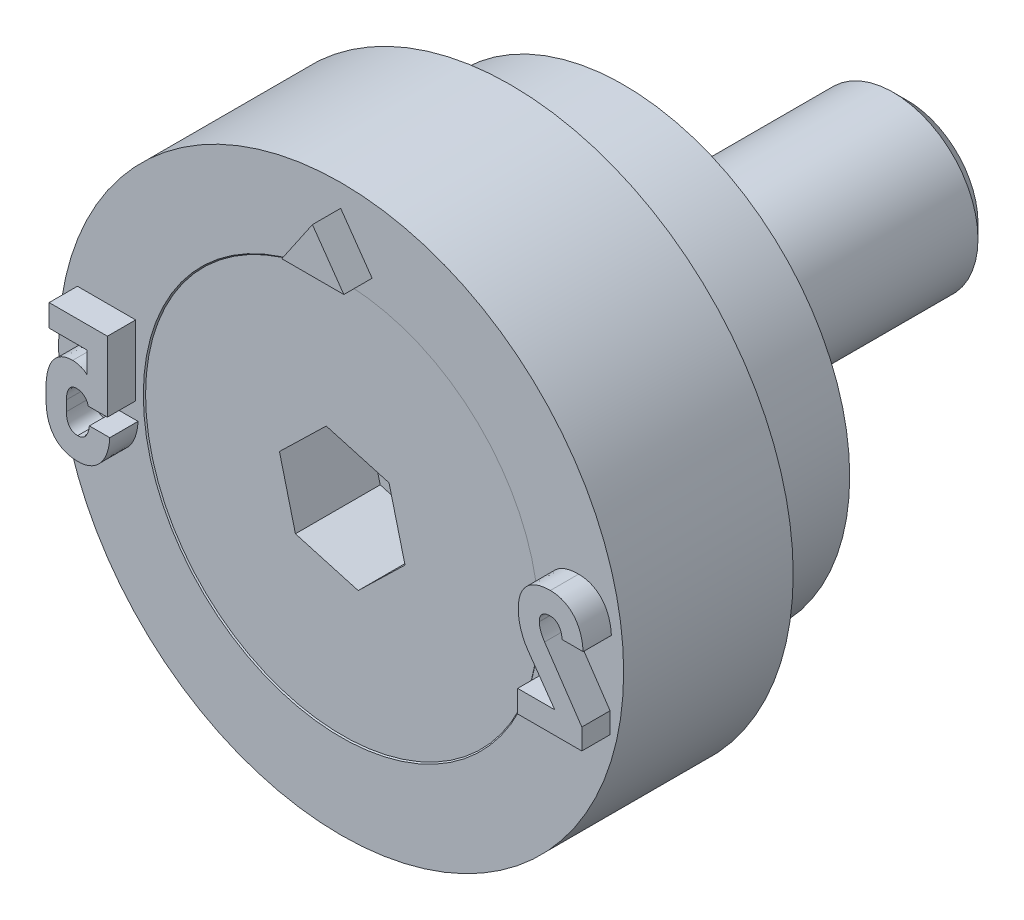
SolidWorks part; units mm, degrees
other "<M3 X .5 FHCS>-<Imported1>"
ref_plane "Front Plane" through (0, 0, 0) normal (0, 0, 1) x (1, 0, 0)
ref_plane "Top Plane" through (0, 0, 0) normal (0, 1, 0) x (1, 0, 0)
ref_plane "Right Plane" through (0, 0, 0) normal (1, 0, 0) x (0, 0, -1)
imported_body "Imported1"
other "DeleteFace1"
sketch "Sketch1" plane through (0, 0, 0) normal (0, 0, 1) x (1, 0, 0)
  line L0 (-0.0071, 4.6037) -> (-0.5487, 3.81)
  line L1 (-0.5487, 3.81) -> (0.5487, 3.81)
  line L2 (0.5487, 3.81) -> (-0.0071, 4.6037)
  text T0 "2             5" font "Bahnschrift" height 2.159
  dimension "D1" = 1.0795
  dimension "D2" = 4.9022
extrude "Boss-Extrude1" add sketch "Sketch1" along normal blind 0.5
inserted part "M3 X .5 FHCS"
move or copy body "Body-Move/Copy2" placed by mates yes
